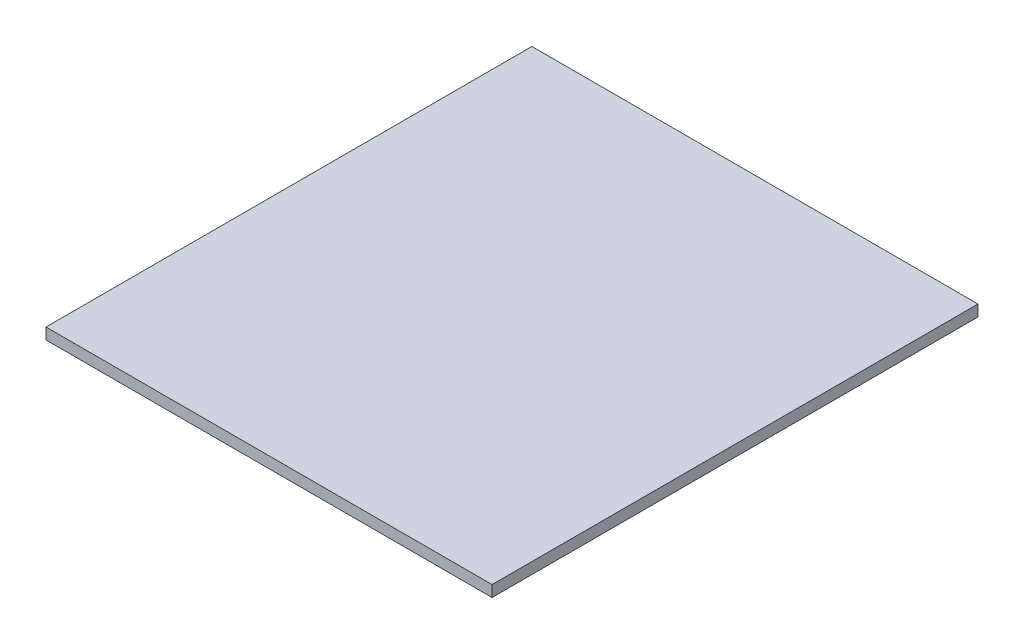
SolidWorks part; units mm, degrees
ref_plane "Спереди" through (0, 0, 0) normal (0, 0, 1) x (1, 0, 0)
ref_plane "Сверху" through (0, 0, 0) normal (0, 1, 0) x (1, 0, 0)
ref_plane "Справа" through (0, 0, 0) normal (1, 0, 0) x (0, 0, -1)
sketch "Эскиз1" plane through (0, 0, 0) normal (0, 1, 0) x (1, 0, 0)
  line L0 (-40, 43.55) -> (-40, 31) construction
  line L1 (39.75, -43.3) -> (-39.75, -43.3)
  line L2 (39.75, -43.3) -> (39.75, 43.3)
  line L3 (39.75, 43.3) -> (-39.75, 43.3)
  line L4 (-39.75, -43.3) -> (-39.75, 43.3)
  line L5 (39.75, -43.3) -> (-39.75, 43.3) construction
  line L6 (39.75, 43.3) -> (-39.75, -43.3) construction
  line L7 (-38, 43.55) -> (38, 43.55) construction
  point P0 (0, 0)
  dimension "D1" = 0.25
  dimension "D2" = 0.25
extrude "Бобышка-Вытянуть1" add sketch "Эскиз1" along normal blind 2
